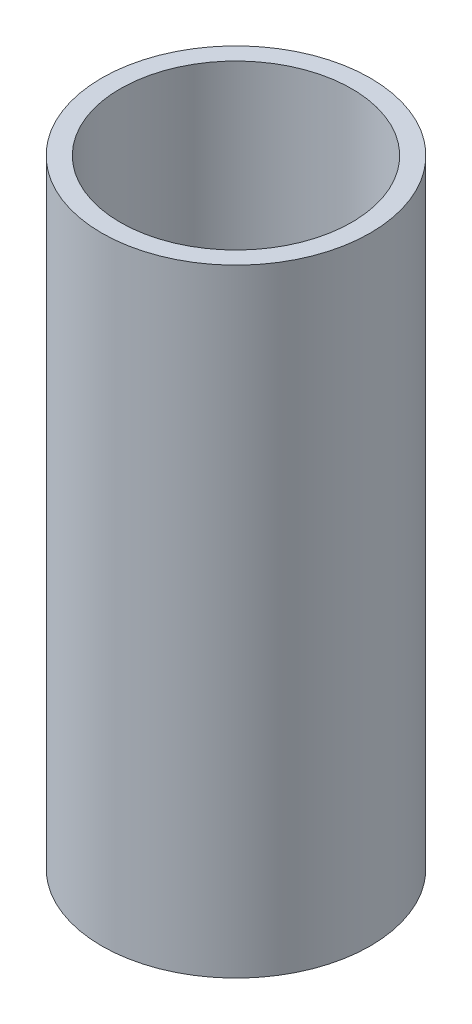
SolidWorks part; units mm, degrees
ref_plane "Front Plane" through (0, 0, 0) normal (0, 0, 1) x (1, 0, 0)
ref_plane "Top Plane" through (0, 0, 0) normal (0, 1, 0) x (1, 0, 0)
ref_plane "Right Plane" through (0, 0, 0) normal (1, 0, 0) x (0, 0, -1)
sketch "Sketch1" plane through (0, 0, 0) normal (0, 1, 0) x (1, 0, 0)
  circle A0 centre (0, 0) radius 19.05
  circle A1 centre (0, 0) radius 22.098
  dimension "D2" = 38.1
  dimension "D1" = 3.048
extrude "Boss-Extrude1" add sketch "Sketch1" along normal mid plane 101.6
